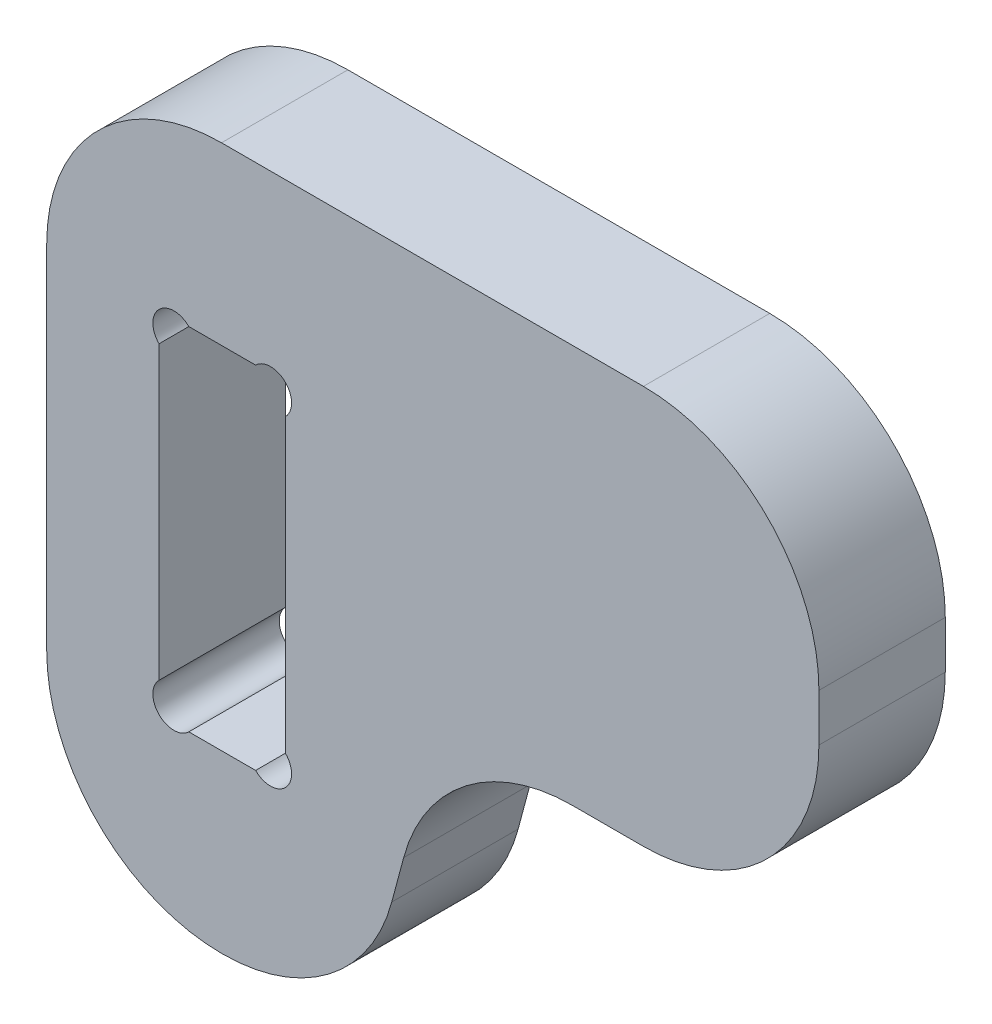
SolidWorks part; units mm, degrees
ref_plane "Plan de face" through (0, 0, 0) normal (0, 0, 1) x (1, 0, 0)
ref_plane "Plan de dessus" through (0, 0, 0) normal (0, 1, 0) x (1, 0, 0)
ref_plane "Plan de droite" through (0, 0, 0) normal (1, 0, 0) x (0, 0, -1)
sketch "Esquisse2" plane through (0, 0, 0) normal (0, 0, 1) x (1, 0, 0)
  line L0 (74.9, -6.7542) -> (110, -6.7542)
  line L2 (0, 0) -> (0, 25.1)
  line L3 (24.9, 50) -> (110, 50)
  line L6 (0, 0) -> (0, -25.1)
  line L7 (24.9, -50) -> (25.1, -50)
  line L9 (110, 50) -> (110, -6.7542)
  line L21 (49.1521, -31.5426) -> (50.8479, -25.2116)
  arc A3 (74.9, -6.7542) -> (50.8479, -25.2116) centre (74.9, -31.6542) ccw
  arc A4 (25.1, -50) -> (49.1521, -31.5426) centre (25.1, -25.1) ccw
  arc A5 (24.9, -50) -> (0, -25.1) centre (24.9, -25.1) cw
  arc A6 (0, 25.1) -> (24.9, 50) centre (24.9, 25.1) cw
  point P21 (50, -50)
  dimension "D9" = 24.9
  dimension "D1" = 56.7542
  dimension "D2" = 110
extrude "Boss.-Extru.2" add sketch "Esquisse2" along normal blind 18
fillet "Congé3" radius 25 2 edges at (110, -6.7542, 9) (110, 50, 9)
sketch "Esquisse3" plane through (0, 0, 18) normal (0, 0, 1) x (1, 0, 0)
  line L0 (24.9, 50) -> (25.1, -50) construction
  line L2 (16, -25) -> (34, -25)
  line L3 (16, -25) -> (16, 25)
  line L4 (16, 25) -> (34, 25)
  line L5 (34, -25) -> (34, 25)
  line L6 (16, -25) -> (34, 25) construction
  line L7 (16, 25) -> (34, -25) construction
  point P4 (25, 0)
  dimension "D1" = 18
  dimension "D2" = 50
extrude "Enlèv. mat.-Extru.1" cut sketch "Esquisse3" against normal through all contours L4 L3 L2 L0 | L2 L5 L4 L0
sketch "Esquisse4" plane through (0, 0, 18) normal (0, 0, 1) x (1, 0, 0)
  line L0 (25, 25) -> (25, -25) construction
  line L1 (16, 25) -> (34, 25) construction
  line L2 (16, -25) -> (34, -25) construction
  line L3 (16, 0) -> (34, 0) construction
  line L4 (16, -25) -> (16, 25) construction
  line L5 (34, -25) -> (34, 25) construction
  line L6 (18.1213, 22.8787) -> (18.1213, 25) construction
  line L7 (18.1213, 22.8787) -> (16, 22.8787) construction
  circle A0 centre (18.1213, 22.8787) radius 3
  circle A1 centre (31.8787, -22.8787) radius 3
  circle A2 centre (31.8787, 22.8787) radius 3
  circle A3 centre (18.1213, -22.8787) radius 3
  point P12 (25, 0)
  point P23 (25, 0)
  dimension "D1" = 6
  dimension "D2" = 2
extrude "Enlèv. mat.-Extru.2" cut sketch "Esquisse4" against normal through all
